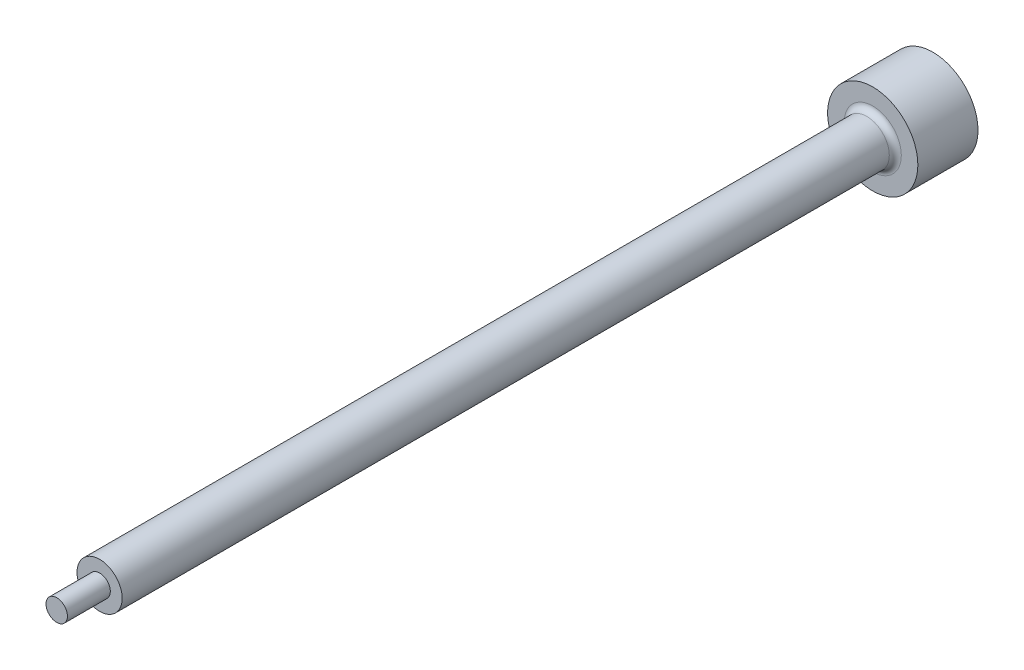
SolidWorks part; units mm, degrees
ref_plane "Face" through (0, 0, 0) normal (0, 0, 1) x (1, 0, 0)
ref_plane "Dessus" through (0, 0, 0) normal (0, 1, 0) x (1, 0, 0)
ref_plane "Droite" through (0, 0, 0) normal (1, 0, 0) x (0, 0, -1)
sketch "Esquisse1" plane through (0, 0, 0) normal (0, 0, 1) x (1, 0, 0)
  circle A0 centre (0, 0) radius 1.5
  dimension "D1" = 3
extrude "Tête" add sketch "Esquisse1" along normal blind 2
sketch "Esquisse2" plane through (0, 0, 2) normal (0, 0, 1) x (1, 0, 0)
  circle A0 centre (0, 0) radius 0.75
  dimension "D1" = 1.5
extrude "Partie active" add sketch "Esquisse2" along normal offset from surface (98 mm away) 100
fillet "Congé1" radius 0.2
sketch "Esquisse3" plane through (0, 0, 100) normal (0, 0, 1) x (1, 0, 0)
  circle A1 centre (0, 0) radius 0.75
  circle A2 centre (0, 0) radius 0.75
  dimension "D1" = 0
extrude "Mise à longueur" cut sketch "Esquisse3" against normal up to surface (70.8648 mm away)
other "Empreinte1"
other "Carter<1>@jeu blocs empreintes droit_Etudiant_Corrigé"
